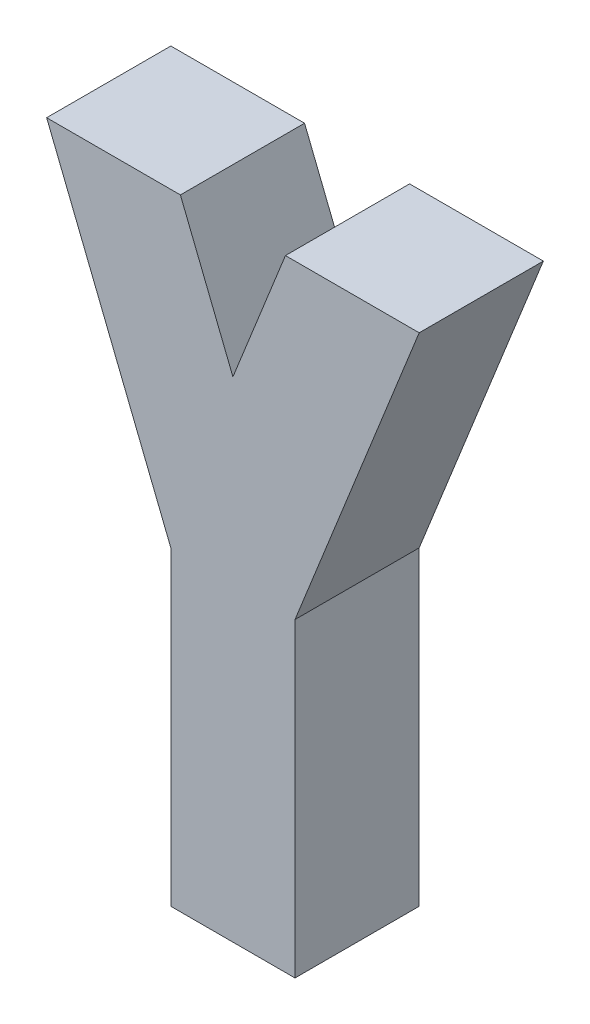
SolidWorks part; units mm, degrees
ref_plane "Plan de face" through (0, 0, 0) normal (0, 0, 1) x (1, 0, 0)
ref_plane "Plan de dessus" through (0, 0, 0) normal (0, 1, 0) x (1, 0, 0)
ref_plane "Plan de droite" through (0, 0, 0) normal (1, 0, 0) x (0, 0, -1)
sketch "Esquisse1" plane through (0, 0, 0) normal (0, 0, 1) x (1, 0, 0)
  line L0 (10, 0) -> (10, 25)
  line L1 (10, 0) -> (20, 0)
  line L3 (0, 50) -> (10.7703, 50)
  line L5 (10, 25) -> (0, 50)
  line L6 (20, 0) -> (20, 25)
  line L7 (20, 25) -> (30, 50)
  line L8 (10.7703, 50) -> (15, 39.4258)
  line L9 (19.2297, 50) -> (15, 39.4258)
  line L10 (19.2297, 50) -> (30, 50)
  dimension "D5" = 25
  dimension "D6" = 25
  dimension "D7" = 10
  dimension "D8" = 10
extrude "Boss.-Extru.1" add sketch "Esquisse1" along normal blind 10
